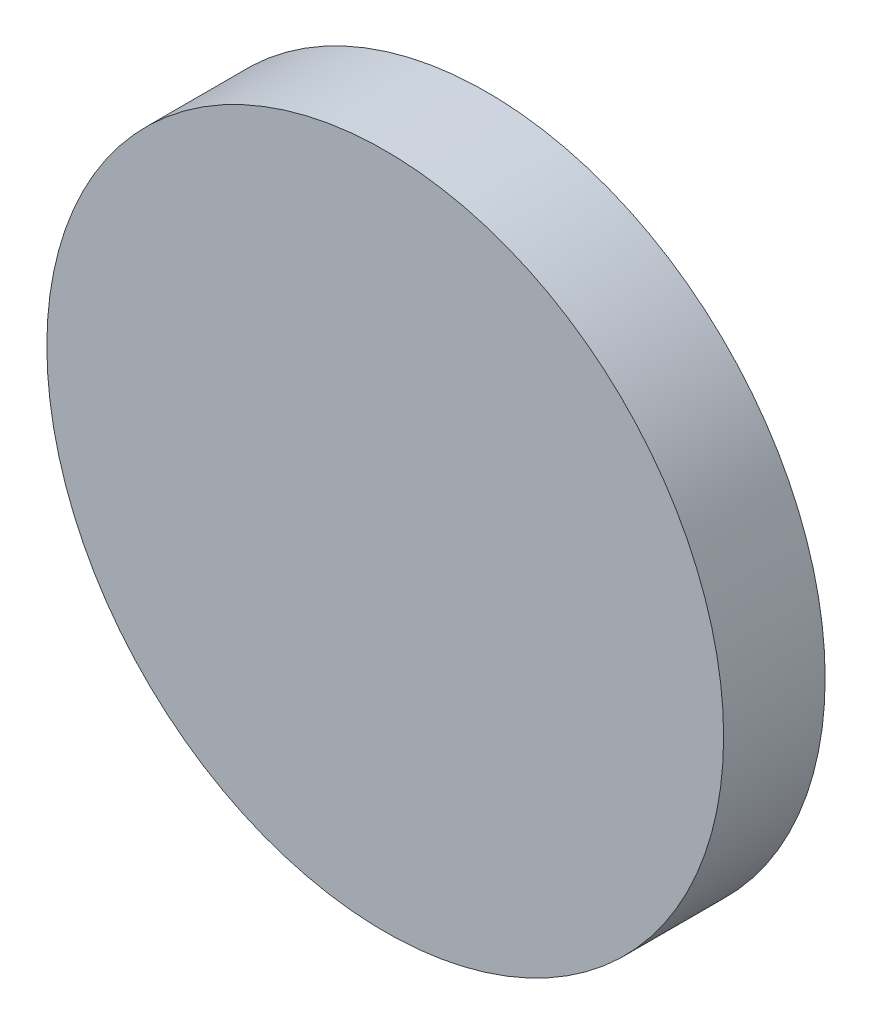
SolidWorks part; units mm, degrees
ref_plane "Front Plane" through (0, 0, 0) normal (0, 0, 1) x (1, 0, 0)
ref_plane "Top Plane" through (0, 0, 0) normal (0, 1, 0) x (1, 0, 0)
ref_plane "Right Plane" through (0, 0, 0) normal (1, 0, 0) x (0, 0, -1)
sketch "Sketch1" plane through (0, 0, 0) normal (0, 0, 1) x (1, 0, 0)
  circle A0 centre (-20, -24.7474) radius 10 construction
  circle A1 centre (-20, -24.7474) radius 10
extrude "Boss-Extrude1" add sketch "Sketch1" against normal blind 3
